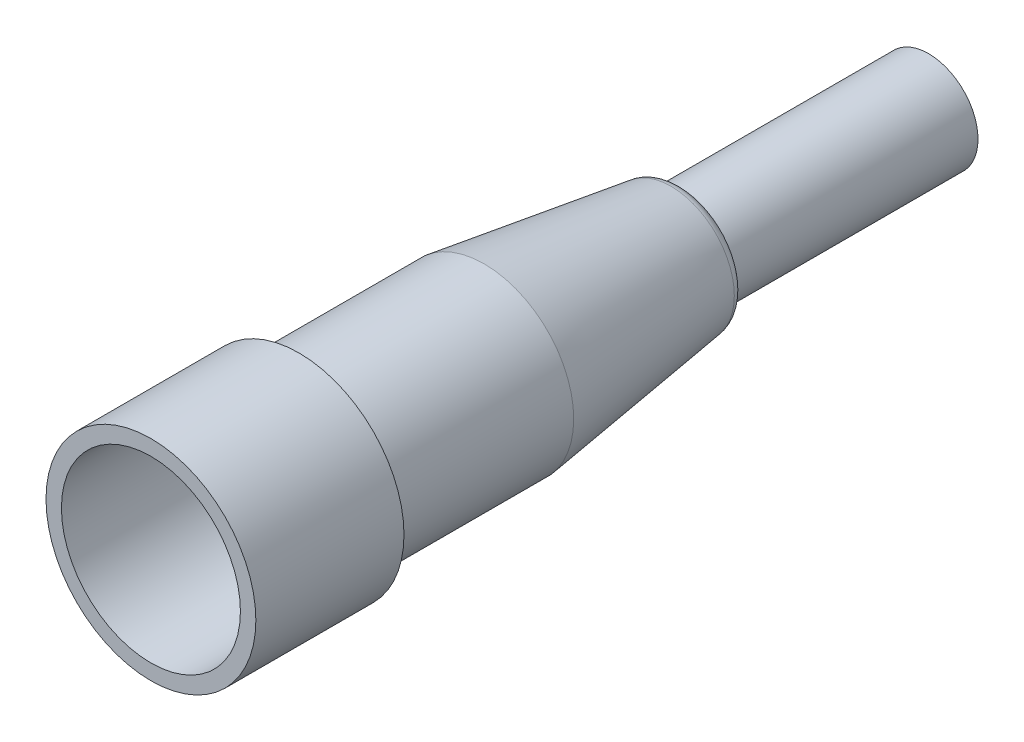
SolidWorks part; units mm, degrees
ref_plane "Face" through (0, 0, 0) normal (0, 0, 1) x (1, 0, 0)
ref_plane "Dessus" through (0, 0, 0) normal (0, 1, 0) x (1, 0, 0)
ref_plane "Droite" through (0, 0, 0) normal (1, 0, 0) x (0, 0, -1)
sketch "Esquisse1" plane through (0, 0, 0) normal (0, 0, 1) x (1, 0, 0)
  circle A0 centre (0, 0) radius 7.25
  dimension "D1" = 14.5
extrude "Base-Extrusion" add sketch "Esquisse1" along normal mid plane 30
sketch "Esquisse9" plane through (0, 0, 15) normal (0, 0, 1) x (1, 0, 0)
  circle A1 centre (0, 0) radius 7.25
  circle A2 centre (0, 0) radius 7.25
  dimension "D1" = 0
extrude "Extrusion1" add sketch "Esquisse9" along normal blind 1
sketch "Esquisse10" plane through (0, 0, 16) normal (0, 0, 1) x (1, 0, 0)
  circle A0 centre (0, 0) radius 8.5
  dimension "D1" = 17
extrude "Extrusion2" add sketch "Esquisse10" along normal blind 12 separate body
sketch "Esquisse11" plane through (0, 0, 28) normal (0, 0, 1) x (1, 0, 0)
  circle A0 centre (0, 0) radius 7.25
  dimension "D1" = 14.5
extrude "Enlèv. mat.-Extru.4" cut sketch "Esquisse11" against normal blind 12
sketch "Esquisse12" plane through (0, 0, 0) normal (0, 1, 0) x (1, 0, 0)
  line L0 (7.25, -1) -> (5, 15)
  line L1 (7.25, -16) -> (7.25, 15) construction
  line L2 (7.25, 15) -> (-7.25, 15) construction
  line L3 (5, 15) -> (7.25, 15)
  line L4 (7.25, 15) -> (7.25, -1)
  line L5 (0, -16) -> (0, 15) construction
  line L6 (0, 0) -> (0, 17.2621) construction
  dimension "D1" = 10
  dimension "D2" = 16
revolve "Enlèvement de matière-Révolution1" cut sketch "Esquisse12" angle 360 about L6
fillet "Congé1" radius 1 1 edges at (5, 0, -15)
sketch "Esquisse13" plane through (0, 0, -15) normal (0, 0, -1) x (-1, 0, 0)
  circle A0 centre (0, 0) radius 4
  dimension "D1" = 8
extrude "Extrusion3" add sketch "Esquisse13" along normal blind 20
